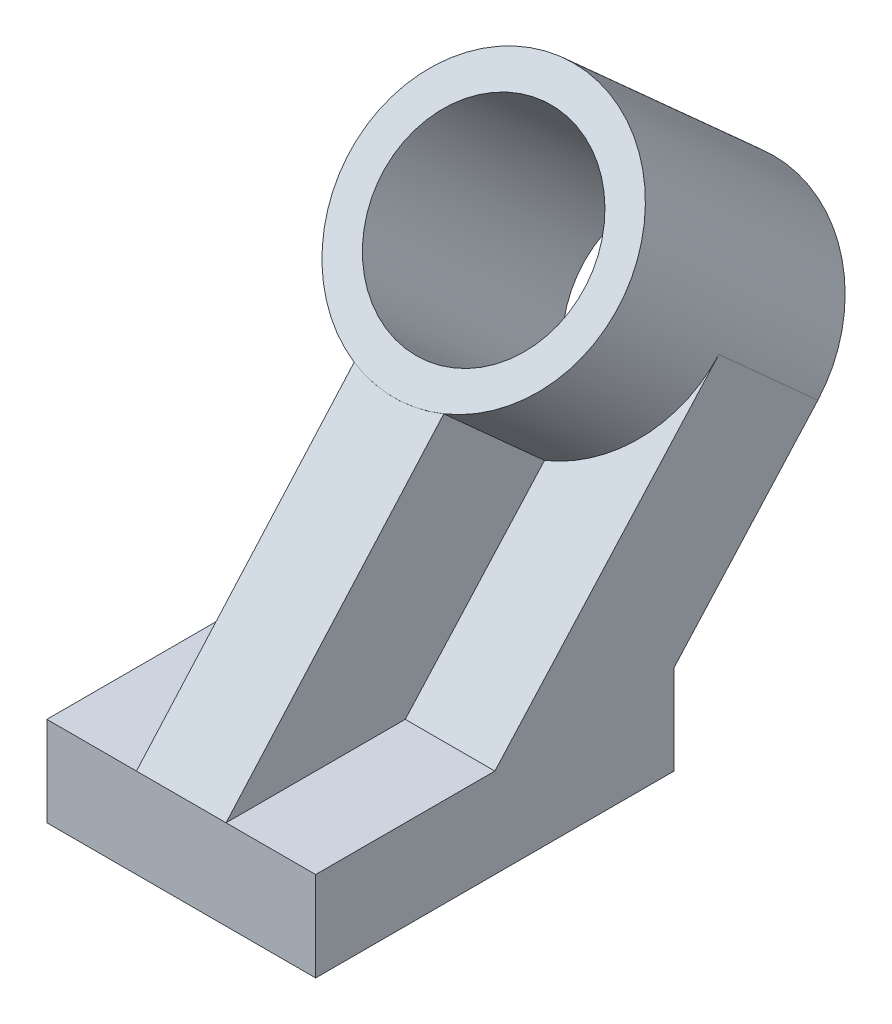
SolidWorks part; units mm, degrees
ref_plane "Front Plane" through (0, 0, 0) normal (0, 0, 1) x (1, 0, 0)
ref_plane "Top Plane" through (0, 0, 0) normal (0, 1, 0) x (1, 0, 0)
ref_plane "Right Plane" through (0, 0, 0) normal (1, 0, 0) x (0, 0, -1)
sketch "Sketch1" plane through (0, 0, 0) normal (1, 0, 0) x (0, 0, -1)
  line L0 (0, 0) -> (0, 25.4)
  line L1 (0, 25.4) -> (50.8, 25.4)
  line L2 (50.8, 25.4) -> (114.3, 95.9239)
  line L3 (114.3, 95.9239) -> (142.355, 70.663)
  line L4 (142.355, 70.663) -> (101.6, 25.4)
  line L5 (101.6, 25.4) -> (101.6, 0)
  line L6 (101.6, 0) -> (0, 0)
  dimension "D1" = 25.4
  dimension "D2" = 50.8
  dimension "D3" = 101.6
  dimension "D4" = 48
  dimension "D5" = 114.3
extrude "Boss-Extrude1" add sketch "Sketch1" along normal mid plane 76.2
sketch "Sketch3" plane through (0, -39.1492, -43.4796) normal (0, -0.6691, -0.7431) x (-1, 0, 0)
  line L0 (-38.1, 147.767) -> (38.1, 147.767) construction
  circle A0 centre (0, 147.767) radius 38.1
extrude "Boss-Extrude2" add sketch "Sketch3" against normal blind 76.2
sketch "Sketch4" plane through (0, 11.8385, 13.148) normal (0, 0.6691, 0.7431) x (1, 0, 0)
  circle A0 centre (0, 147.767) radius 28.575
  dimension "D1" = 57.15
extrude "Cut-Extrude1" cut sketch "Sketch4" against normal through all
ref_plane "Plane2" through (0, 0, 0) normal (-1, 0, 0) x (0, 0, 1)
sketch "Sketch9" plane through (0, 0, 0) normal (-1, 0, 0) x (0, 0, 1)
  line L0 (-66.607, 100.4154) -> (0, 25.4)
  line L4 (-60.2335, 93.337) -> (-111.2213, 149.9646) construction
rib "Rib23" sketch "Sketch9" sketch "Sketch9" thickness 25.4 extrusion direction parallel to sketch draft on no parameters "D1"=25.4
